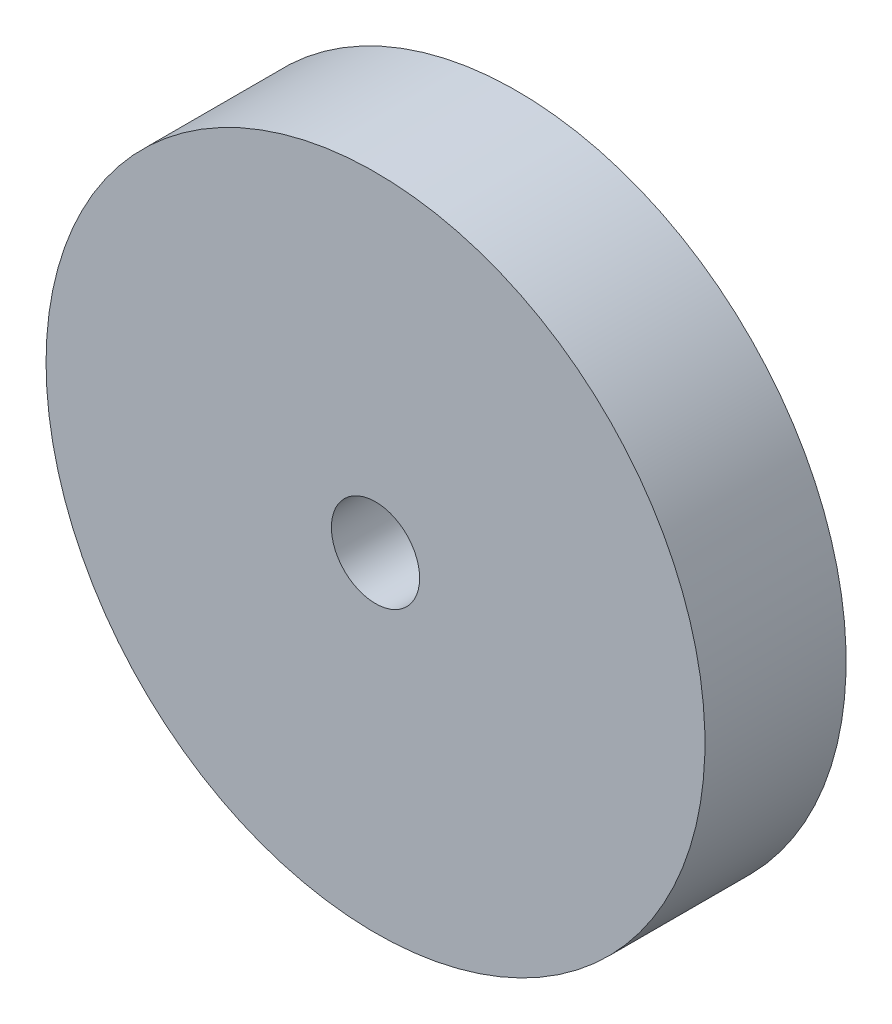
SolidWorks part; units mm, degrees
ref_plane "Front Plane" through (0, 0, 0) normal (0, 0, 1) x (1, 0, 0)
ref_plane "Top Plane" through (0, 0, 0) normal (0, 1, 0) x (1, 0, 0)
ref_plane "Right Plane" through (0, 0, 0) normal (1, 0, 0) x (0, 0, -1)
sketch "Sketch1" plane through (0, 0, 392.6924) normal (0, 0, 1) x (1, 0, 0)
  circle A0 centre (30.9534, 4.2212) radius 22.225
  dimension "D1" = 44.45
extrude "Boss-Extrude1" add sketch "Sketch1" along normal blind 9.525
sketch "Sketch2" plane through (0, 0, 402.2174) normal (0, 0, 1) x (1, 0, 0)
  circle A0 centre (30.9534, 4.2212) radius 2.9766
  dimension "D1" = 5.9531
extrude "Cut-Extrude1" cut sketch "Sketch2" against normal blind 9.525
